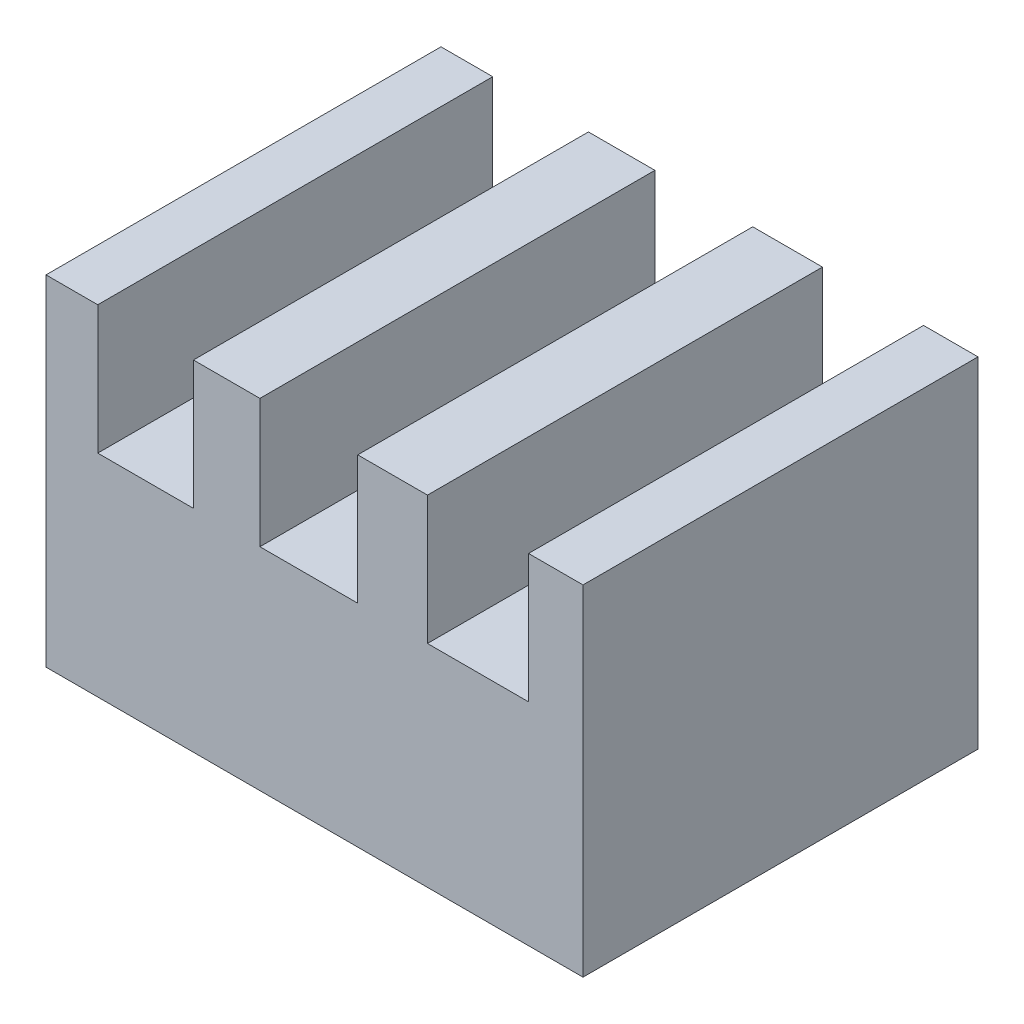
SolidWorks part; units mm, degrees
ref_plane "正面" through (0, 0, 0) normal (0, 0, 1) x (1, 0, 0)
ref_plane "平面" through (0, 0, 0) normal (0, 1, 0) x (1, 0, 0)
ref_plane "右側面" through (0, 0, 0) normal (1, 0, 0) x (0, 0, -1)
sketch "ｽｹｯﾁ1" plane through (0, 0, 0) normal (0, 1, 0) x (1, 0, 0)
  line L1 (1.391, 0) -> (53.5539, 0)
  line L2 (1.391, 0) -> (1.391, 38.3687)
  line L3 (1.391, 38.3687) -> (53.5539, 38.3687)
  line L4 (53.5539, 0) -> (53.5539, 38.3687)
extrude "ﾎﾞｽ - 押し出し1" add sketch "ｽｹｯﾁ1" along normal blind 33
sketch "ｽｹｯﾁ2" plane through (0, 0, 0) normal (0, 0, 1) x (1, 0, 0)
  line L0 (1.391, 33) -> (53.5539, 33) construction
  line L1 (6.4182, 33) -> (15.7115, 33)
  line L2 (6.4182, 33) -> (6.4182, 20.5189)
  line L3 (6.4182, 20.5189) -> (15.7115, 20.5189)
  line L4 (15.7115, 33) -> (15.7115, 20.5189)
  line L6 (22.1695, 33) -> (31.6728, 33)
  line L7 (22.1695, 33) -> (22.1695, 20.5189)
  line L8 (22.1695, 20.5189) -> (31.6728, 20.5189)
  line L9 (31.6728, 33) -> (31.6728, 20.5189)
  line L10 (38.4459, 33) -> (48.2642, 33)
  line L11 (38.4459, 33) -> (38.4459, 20.5189)
  line L12 (38.4459, 20.5189) -> (48.2642, 20.5189)
  line L13 (48.2642, 33) -> (48.2642, 20.5189)
extrude "ｶｯﾄ - 押し出し1" cut sketch "ｽｹｯﾁ2" against normal blind 43
